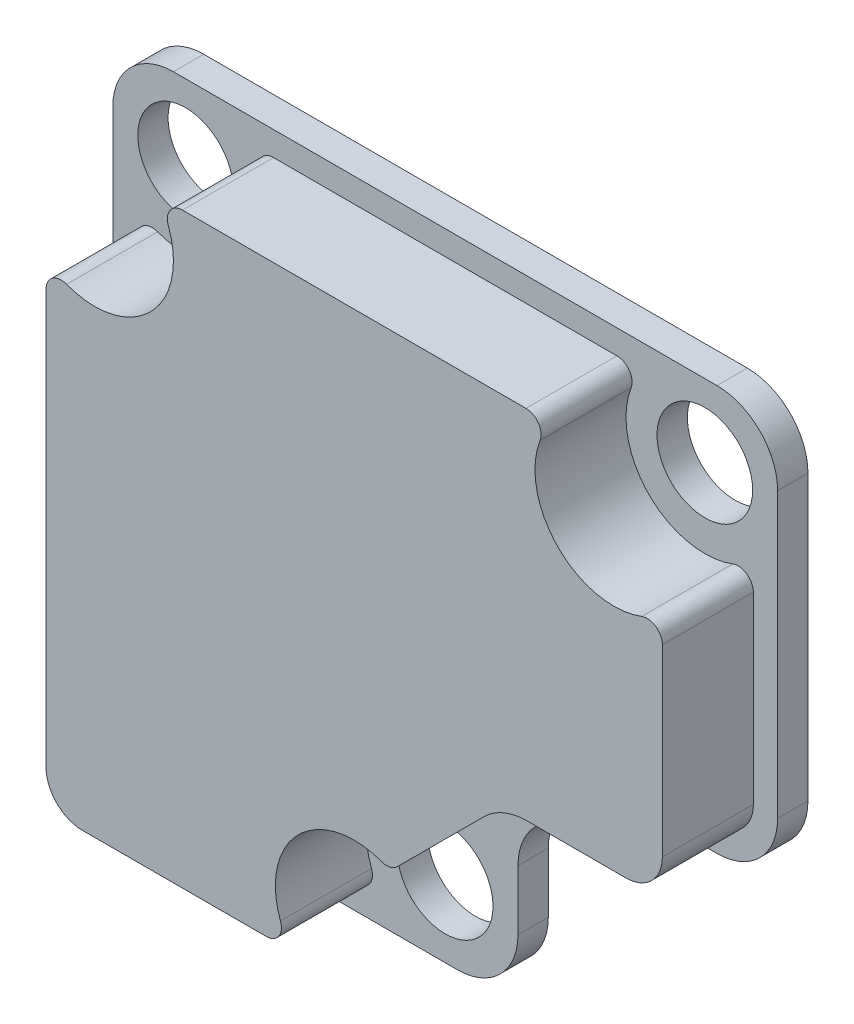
SolidWorks part; units mm, degrees
ref_plane "Front Plane" through (0, 0, 0) normal (0, 0, 1) x (1, 0, 0)
ref_plane "Top Plane" through (0, 0, 0) normal (0, 1, 0) x (1, 0, 0)
ref_plane "Right Plane" through (0, 0, 0) normal (1, 0, 0) x (0, 0, -1)
sketch "Sketch1" plane through (0, 0, 0) normal (0, 0, 1) x (1, 0, 0)
  line L1 (0, 0) -> (69.596, 0)
  line L2 (0, 0) -> (0, 66.548)
  line L3 (0, 66.548) -> (69.596, 66.548)
  line L4 (69.596, 0) -> (69.596, 66.548)
  circle A0 centre (7.62, 58.928) radius 5.0038
  circle A1 centre (61.976, 58.928) radius 5.0038
  circle A2 centre (34.798, 7.62) radius 5.0038
  dimension "D3" = 10.0076
  dimension "D4" = 10.0076
  dimension "D5" = 10.0076
  dimension "D2" = 7.62
  dimension "D6" = 7.62
  dimension "D7" = 54.356
  dimension "D8" = 7.62
  dimension "D9" = 51.308
  dimension "D10" = 61.976
  dimension "D11" = 27.178
  dimension "D12" = 7.62
extrude "Boss-Extrude1" add sketch "Sketch1" along normal blind 12.7
sketch "Sketch4" plane through (0, 0, 12.7) normal (0, 0, 1) x (1, 0, 0)
  line L1 (69.596, 0) -> (42.418, 0)
  line L2 (69.596, 0) -> (69.596, 24.13)
  line L3 (69.596, 24.13) -> (51.308, 24.13)
  line L4 (42.418, 0) -> (42.418, 15.24)
  line L5 (0, 66.548) -> (0, 0) construction
  line L6 (69.596, 66.548) -> (0, 66.548) construction
  line L7 (51.308, 24.13) -> (42.418, 15.24)
  dimension "D1" = 42.418
  dimension "D2" = 42.418
  dimension "D3" = 45
  dimension "D4" = 8.89
extrude "Cut-Extrude1" cut sketch "Sketch4" against normal blind 44.45
fillet "Fillet1" radius 6.35 2 edges at (42.418, 15.24, 6.35) (51.308, 24.13, 6.35)
fillet "Fillet2" radius 6.35 5 edges at (0, 0, 6.35) (42.418, 0, 6.35) (69.596, 24.13, 6.35) (69.596, 66.548, 6.35) (0, 66.548, 6.35)
sketch "Sketch23" plane through (0, 0, 12.7) normal (0, 0, 1) x (1, 0, 0)
  line L0 (23.6844, 61.468) -> (45.9116, 61.468)
  line L1 (64.516, 42.8636) -> (64.516, 35.56)
  line L2 (58.166, 29.21) -> (53.9393, 29.21)
  line L4 (46.0596, 26.0658) -> (37.4276, 17.4338)
  line L5 (63.246, 66.548) -> (6.35, 66.548) construction
  line L6 (69.596, 30.48) -> (69.596, 60.198) construction
  line L7 (63.246, 24.13) -> (53.9383, 24.13) construction
  line L8 (49.4481, 22.2701) -> (44.2779, 17.0999) construction
  line L9 (6.35, 43.219) -> (6.35, 11.43)
  line L10 (12.7, 5.08) -> (18.7336, 5.08)
  line L11 (0, 60.198) -> (0, 6.35) construction
  line L12 (6.35, 0) -> (36.068, 0) construction
  arc A0 (10.7462, 49.2609) -> (17.5058, 56.5834) centre (7.62, 58.928) ccw
  arc A1 (52.0902, 56.5834) -> (59.6314, 49.0422) centre (61.976, 58.928) ccw
  arc A2 (37.4276, 17.4338) -> (24.9122, 9.9646) centre (34.798, 7.62) ccw
  arc A3 (64.516, 35.56) -> (58.166, 29.21) centre (58.166, 35.56) cw
  arc A4 (53.9393, 29.21) -> (46.0596, 26.0658) centre (53.9393, 17.7643) ccw
  arc A5 (6.35, 11.43) -> (12.7, 5.08) centre (12.7, 11.43) ccw
  arc A6 (10.7462, 49.2609) -> (6.35, 43.219) centre (12.7, 43.219) ccw
  arc A7 (23.6844, 61.468) -> (17.5058, 56.5834) centre (23.6844, 55.118) ccw
  arc A8 (52.0902, 56.5834) -> (45.9116, 61.468) centre (45.9116, 55.118) ccw
  arc A9 (64.516, 42.8636) -> (59.6314, 49.0422) centre (58.166, 42.8636) ccw
  arc A10 (35.0085, 17.7778) -> (39.6301, 19.6363) centre (35.14, 24.1265) ccw
  arc A11 (18.7336, 5.08) -> (24.9122, 9.9646) centre (18.7336, 11.43) ccw
  dimension "D1" = 20.32
  dimension "D2" = 20.32
  dimension "D3" = 20.32
  dimension "D8" = 6.35
  dimension "D11" = 6.35
  dimension "D12" = 11.4457
  dimension "D13" = 12.7
  dimension "D14" = 12.7
  dimension "D15" = 12.7
  dimension "D16" = 12.7
  dimension "D17" = 12.7
  dimension "D18" = 12.7
  dimension "D4" = 5.08
  dimension "D5" = 5.08
  dimension "D6" = 5.08
  dimension "D7" = 5.08
  dimension "D9" = 6.35
  dimension "D10" = 5.08
extrude "Cut-Extrude2" cut sketch "Sketch23" against normal through all contours L10 A11 A2 A10 L4 A4 L2 A3 L1 A9 A1 A8 L0 A7 A0 A6 L9 A5
sketch "Sketch25" plane through (0, 0, 12.7) normal (0, 0, 1) x (1, 0, 0)
  line L0 (6.35, 11.43) -> (6.35, 43.219)
  line L1 (23.6844, 61.468) -> (45.9116, 61.468)
  line L2 (64.516, 42.8636) -> (64.516, 35.56)
  line L3 (58.166, 29.21) -> (53.9393, 29.21)
  line L4 (46.0596, 26.0658) -> (39.6301, 19.6363)
  line L5 (18.7336, 5.08) -> (12.7, 5.08)
  arc A0 (6.35, 43.219) -> (10.7462, 49.2609) centre (12.7, 43.219) cw
  arc A1 (10.7462, 49.2609) -> (17.5058, 56.5834) centre (7.62, 58.928) ccw
  arc A2 (17.5058, 56.5834) -> (23.6844, 61.468) centre (23.6844, 55.118) cw
  arc A3 (45.9116, 61.468) -> (52.0902, 56.5834) centre (45.9116, 55.118) cw
  arc A4 (52.0902, 56.5834) -> (59.6314, 49.0422) centre (61.976, 58.928) ccw
  arc A5 (59.6314, 49.0422) -> (64.516, 42.8636) centre (58.166, 42.8636) cw
  arc A6 (64.516, 35.56) -> (58.166, 29.21) centre (58.166, 35.56) cw
  arc A7 (53.9393, 29.21) -> (46.0596, 26.0658) centre (53.9393, 17.7643) ccw
  arc A8 (39.6301, 19.6363) -> (35.0085, 17.7778) centre (35.14, 24.1265) cw
  arc A9 (35.0085, 17.7778) -> (24.9122, 9.9646) centre (34.798, 7.62) ccw
  arc A10 (24.9122, 9.9646) -> (18.7336, 5.08) centre (18.7336, 11.43) cw
  arc A11 (12.7, 5.08) -> (6.35, 11.43) centre (12.7, 11.43) cw
extrude "Boss-Extrude2" add sketch "Sketch25" against normal blind 2.54
sketch "Sketch26" plane through (0, 0, 12.7) normal (0, 0, 1) x (1, 0, 0)
  line L0 (14.1268, 64.008) -> (55.4692, 64.008)
  line L1 (67.056, 52.4212) -> (67.056, 30.48)
  line L2 (63.246, 26.67) -> (52.8862, 26.67)
  line L3 (48.396, 24.8101) -> (38.5559, 14.97)
  line L4 (2.54, 52.4212) -> (2.54, 6.35)
  line L5 (6.35, 2.54) -> (28.2912, 2.54)
  line L6 (0, 60.198) -> (0, 6.35) construction
  line L7 (6.35, 0) -> (36.068, 0) construction
  line L8 (0, 60.198) -> (0, 6.35)
  line L9 (49.4481, 22.2701) -> (44.2779, 17.0999) construction
  line L10 (63.246, 24.13) -> (53.9383, 24.13) construction
  line L11 (69.596, 30.48) -> (69.596, 60.198) construction
  line L12 (63.246, 66.548) -> (6.35, 66.548) construction
  line L13 (6.35, 0) -> (36.068, 0)
  line L14 (42.418, 6.35) -> (42.418, 12.6097)
  line L15 (44.2779, 17.0999) -> (49.4481, 22.2701)
  line L16 (53.9383, 24.13) -> (63.246, 24.13)
  line L17 (69.596, 30.48) -> (69.596, 60.198)
  line L18 (63.246, 66.548) -> (6.35, 66.548)
  arc A0 (2.54, 52.4212) -> (14.1268, 64.008) centre (7.62, 58.928) ccw
  arc A1 (55.4692, 64.008) -> (67.056, 52.4212) centre (61.976, 58.928) ccw
  arc A2 (38.5559, 14.97) -> (28.2912, 2.54) centre (34.798, 7.62) ccw
  arc A3 (67.056, 30.48) -> (63.246, 26.67) centre (63.246, 30.48) cw
  arc A4 (52.8862, 26.67) -> (48.396, 24.8101) centre (52.8862, 20.32) ccw
  arc A5 (2.54, 6.35) -> (6.35, 2.54) centre (6.35, 6.35) ccw
  arc A6 (0, 6.35) -> (6.35, 0) centre (6.35, 6.35) ccw
  arc A7 (36.068, 0) -> (42.418, 6.35) centre (36.068, 6.35) ccw
  arc A8 (42.418, 12.6097) -> (44.2779, 17.0999) centre (48.768, 12.6097) cw
  arc A9 (49.4481, 22.2701) -> (53.9383, 24.13) centre (53.9383, 17.78) cw
  arc A10 (63.246, 24.13) -> (69.596, 30.48) centre (63.246, 30.48) ccw
  arc A11 (69.596, 60.198) -> (63.246, 66.548) centre (63.246, 60.198) ccw
  arc A12 (6.35, 66.548) -> (0, 60.198) centre (6.35, 60.198) ccw
  dimension "D1" = 16.51
  dimension "D2" = 16.51
  dimension "D3" = 16.51
  dimension "D9" = 6.35
  dimension "D4" = 2.54
  dimension "D5" = 2.54
  dimension "D6" = 2.54
  dimension "D7" = 2.54
  dimension "D8" = 2.54
  dimension "D10" = 2.54
extrude "Cut-Extrude5" cut sketch "Sketch26" against normal blind 9.525
sketch "Sketch28" plane through (0, 0, 0) normal (0, 0, -1) x (-1, 0, 0)
  line L0 (-47.2199, 64.643) -> (-22.3761, 64.643)
  line L1 (-46.0596, 26.0658) -> (-39.6301, 19.6363) construction
  line L2 (-20.0419, 1.905) -> (-9.8425, 1.905)
  line L3 (-1.905, 9.8425) -> (-1.905, 44.1719)
  line L4 (-6.35, 43.219) -> (-6.35, 11.43) construction
  line L5 (-41.3821, 16.8982) -> (-48.1941, 23.7102)
  line L6 (-53.8067, 26.035) -> (-59.7535, 26.035)
  line L7 (-67.691, 33.9725) -> (-67.691, 44.1719)
  line L8 (-12.7, 5.08) -> (-18.7336, 5.08) construction
  line L10 (-23.6844, 61.468) -> (-45.9116, 61.468) construction
  line L11 (-64.516, 42.8636) -> (-64.516, 35.56) construction
  line L12 (-58.166, 29.21) -> (-53.9393, 29.21) construction
  arc A0 (-60.9357, 52.0209) -> (-55.0689, 57.8877) centre (-61.976, 58.928) ccw
  arc A1 (-14.5271, 57.8877) -> (-8.6603, 52.0209) centre (-7.62, 58.928) ccw
  arc A2 (-27.8909, 8.6603) -> (-35.2527, 14.5902) centre (-34.798, 7.62) ccw
  arc A3 (-14.5271, 57.8877) -> (-22.3761, 64.643) centre (-22.3761, 56.7055) ccw
  arc A5 (-47.2199, 64.643) -> (-55.0689, 57.8877) centre (-47.2199, 56.7055) ccw
  arc A6 (-60.9357, 52.0209) -> (-67.691, 44.1719) centre (-59.7535, 44.1719) ccw
  arc A7 (-41.3821, 16.8982) -> (-35.2527, 14.5902) centre (-35.7694, 22.5108) ccw
  arc A8 (-27.8909, 8.6603) -> (-20.0419, 1.905) centre (-20.0419, 9.8425) ccw
  arc A9 (-9.8425, 1.905) -> (-1.905, 9.8425) centre (-9.8425, 9.8425) ccw
  arc A10 (-1.905, 44.1719) -> (-8.6603, 52.0209) centre (-9.8425, 44.1719) ccw
  arc A11 (-67.691, 33.9725) -> (-59.7535, 26.035) centre (-59.7535, 33.9725) ccw
  arc A12 (-48.1941, 23.7102) -> (-53.8067, 26.035) centre (-53.8067, 18.0975) ccw
  dimension "D1" = 13.97
  dimension "D2" = 13.97
  dimension "D3" = 13.97
  dimension "D8" = 4.445
  dimension "D10" = 15.875
  dimension "D11" = 15.875
  dimension "D12" = 15.875
  dimension "D13" = 15.875
  dimension "D14" = 15.875
  dimension "D15" = 15.875
  dimension "D16" = 15.875
  dimension "D17" = 15.875
  dimension "D18" = 15.875
  dimension "D4" = 3.175
  dimension "D5" = 3.175
  dimension "D6" = 3.175
  dimension "D7" = 3.175
  dimension "D9" = 3.175
extrude "Cut-Extrude6" cut sketch "Sketch28" against normal blind 1.4986
fillet "Fillet3" radius 1.5875 6 edges at (14.1268, 64.008, 7.9375) (67.056, 52.4212, 7.9375) (55.4692, 64.008, 7.9375) (38.5559, 14.97, 7.9375) (28.2912, 2.54, 7.9375) (2.54, 52.4212, 7.9375)
sketch "Sketch29" plane through (0, 0, 0) normal (0, 0, -1) x (-1, 0, 0)
  line L0 (-53.9393, 29.21) -> (-58.166, 29.21)
  line L1 (-64.516, 35.56) -> (-64.516, 42.8636)
  line L2 (-45.9116, 61.468) -> (-23.6844, 61.468)
  line L3 (-6.35, 43.219) -> (-6.35, 11.43)
  line L4 (-12.7, 5.08) -> (-18.7336, 5.08)
  line L5 (-39.6301, 19.6363) -> (-46.0596, 26.0658)
  arc A0 (-58.166, 29.21) -> (-64.516, 35.56) centre (-58.166, 35.56) cw
  arc A1 (-64.516, 35.56) -> (-58.166, 29.21) centre (-58.166, 35.56) ccw construction
  arc A2 (-64.516, 42.8636) -> (-59.6314, 49.0422) centre (-58.166, 42.8636) cw
  arc A3 (-59.6314, 49.0422) -> (-52.0902, 56.5834) centre (-61.976, 58.928) ccw
  arc A4 (-52.0902, 56.5834) -> (-45.9116, 61.468) centre (-45.9116, 55.118) cw
  arc A5 (-23.6844, 61.468) -> (-17.5058, 56.5834) centre (-23.6844, 55.118) cw
  arc A6 (-17.5058, 56.5834) -> (-10.7462, 49.2609) centre (-7.62, 58.928) ccw
  arc A7 (-10.7462, 49.2609) -> (-6.35, 43.219) centre (-12.7, 43.219) cw
  arc A8 (-6.35, 11.43) -> (-12.7, 5.08) centre (-12.7, 11.43) cw
  arc A9 (-18.7336, 5.08) -> (-24.9122, 9.9646) centre (-18.7336, 11.43) cw
  arc A10 (-24.9122, 9.9646) -> (-35.0085, 17.7778) centre (-34.798, 7.62) ccw
  arc A11 (-35.0085, 17.7778) -> (-39.6301, 19.6363) centre (-35.14, 24.1265) cw
  arc A12 (-46.0596, 26.0658) -> (-53.9393, 29.21) centre (-53.6592, 18.4661) ccw
